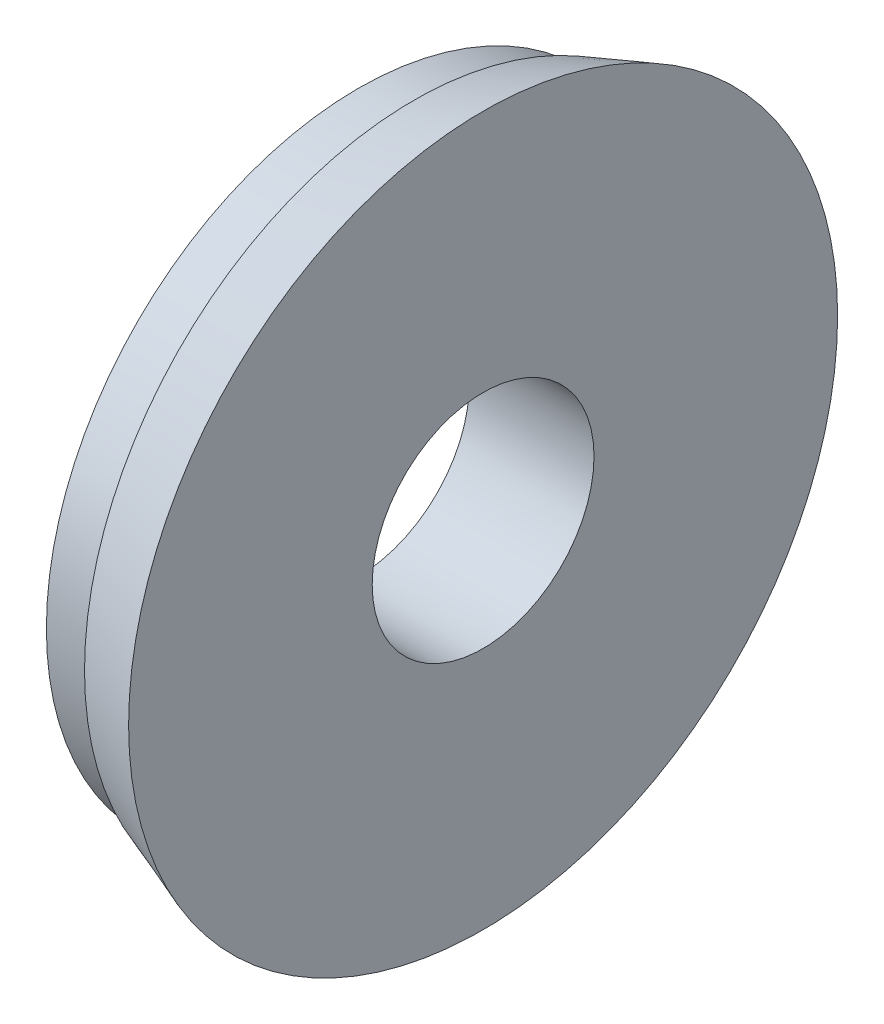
SolidWorks part; units mm, degrees
ref_plane "Plane1" through (0, 0, 0) normal (0, 0, 1) x (1, 0, 0)
ref_plane "Plane2" through (0, 0, 0) normal (0, 1, 0) x (1, 0, 0)
ref_plane "Plane3" through (0, 0, 0) normal (1, 0, 0) x (0, 0, -1)
sketch "Sketch1" plane through (0, 0, 0) normal (0, 0, 1) x (1, 0, 0)
  line L0 (-34.925, 0) -> (9.525, 0) construction
  line L1 (0, 3.2) -> (0, 9)
  line L2 (0, 9) -> (-1.6, 9)
  line L3 (-1.6, 9) -> (-1.6, 3.2)
  line L4 (-1.6, 3.2) -> (0, 3.2)
  dimension "Thickness" = 1.6
  dimension "Inside_dia" = 6.4
  dimension "Outside_dia" = 18
revolve "Base-Revolve" add sketch "Sketch1" angle 360 about L0
sketch "Esquisse1" plane through (0, 0, 0) normal (1, 0, 0) x (0, 0, -1)
  circle A0 centre (0, 0) radius 9.5
  dimension "D1" = 19
extrude "Extrusion1" add sketch "Esquisse1" along normal blind 2 draft 20
sketch "Esquisse2" plane through (0, 0, 0) normal (-1, 0, 0) x (0, 0, 1)
  circle A1 centre (0, 0) radius 3.2
  circle A2 centre (0, 0) radius 3.2
  dimension "D1" = 0
extrude "Extrusion2" cut sketch "Esquisse2" against normal up to next
